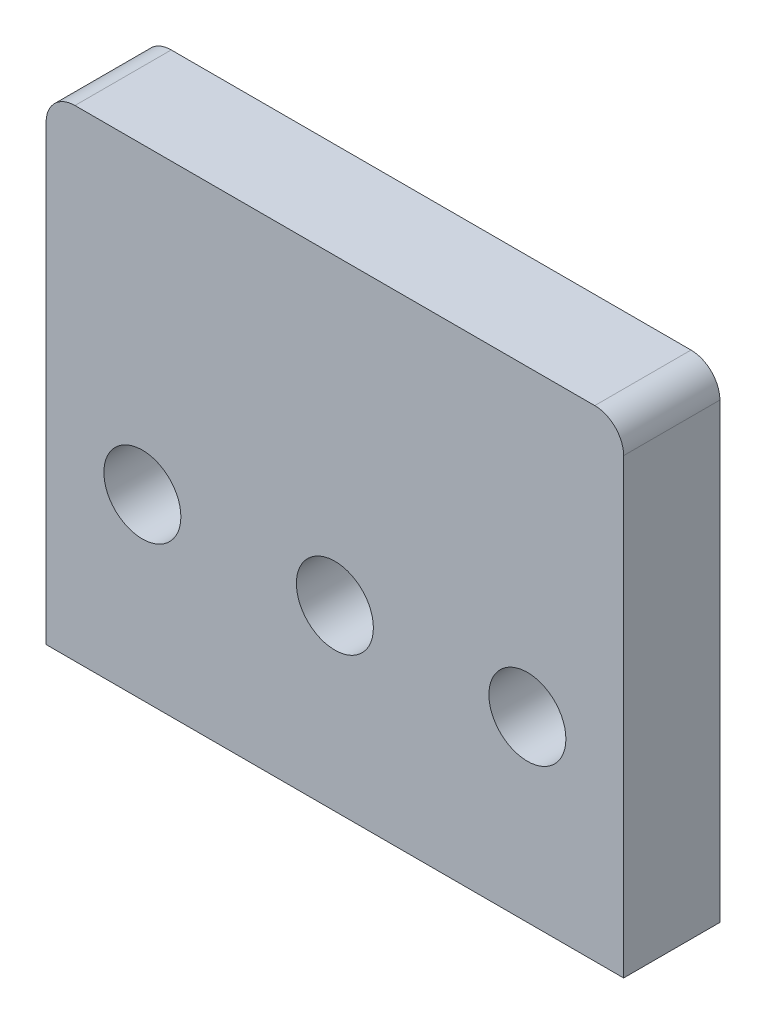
SolidWorks part; units mm, degrees
ref_plane "Plan1" through (0, 0, 0) normal (0, 0, 1) x (1, 0, 0)
ref_plane "Plan2" through (0, 0, 0) normal (0, 1, 0) x (1, 0, 0)
ref_plane "Plan3" through (0, 0, 0) normal (1, 0, 0) x (0, 0, -1)
sketch "Esquisse1" plane through (0, 0, 0) normal (0, 0, 1) x (1, 0, 0)
  line L0 (-30, -18.5) -> (30, -18.5)
  line L1 (-30, -18.5) -> (-30, 31.5)
  line L2 (30, 31.5) -> (-30, 31.5)
  line L3 (30, 31.5) -> (30, -18.5)
extrude "Base-Extrusion" add sketch "Esquisse1" along normal blind 10
fillet "Congé1" radius 3
sketch "Esquisse2" plane through (0, 0, 10) normal (0, 0, 1) x (1, 0, 0)
  circle A0 centre (-20, 0) radius 4
  circle A1 centre (0, 0) radius 4
  circle A2 centre (20, 0) radius 4
  dimension "D1" = 8
  dimension "D2" = 8
  dimension "D3" = 8
extrude "Enlèv. mat.-Extru.1" cut sketch "Esquisse2" against normal blind 10
sketch "Esquisse3" plane through (0, 0, 10) normal (0, 0, 1) x (1, 0, 0)
  line L0 (20, 22) -> (20, -14) construction
ref_plane "Plan5" [suppressed] through (0.4943, 0, 10.8857) normal (0.0454, 0, 0.999) x (0.999, 0, -0.0454)
sketch "Esquisse5" plane through (0, 0, 10) normal (0, 0, 1) x (1, 0, 0)
  line L0 (-24, 33) -> (-24, 5) construction
sketch "Esquisse6" [suppressed] plane through (0.4943, 0, 10.8857) normal (0.0454, 0, 0.999) x (0.999, 0, -0.0454)
  line L0 (-33, 26.1607) -> (36, 26.1607) construction
  line L3 (-24.4289, 33) -> (-24.4289, 5) construction
  line L4 (-24.4289, 29.3357) -> (19.3871, 29.3357)
  line L5 (22.5621, 26.1607) -> (-27.6039, 26.1607)
  arc A0 (19.3871, 29.3357) -> (22.5621, 26.1607) centre (19.3871, 26.1607) cw
  arc A1 (-24.4289, 29.3357) -> (-27.6039, 26.1607) centre (-24.4289, 26.1607) ccw
  dimension "D1" = 3.175
revolve "Enlever de la matière-Révolution1" [suppressed] cut sketch "Esquisse6" angle 360 about L0
sketch "Esquisse7" [suppressed] plane through (0.4943, 0, 10.8857) normal (0.0454, 0, 0.999) x (0.999, 0, -0.0454)
  line L0 (-34, 15.5) -> (32, 15.5) construction
  line L1 (26.5186, 31.5) -> (-27.4258, 31.5) construction
  line L2 (-24.4289, 12.32) -> (19.5258, 12.32)
  line L5 (-24.4289, 33) -> (-24.4289, 5) construction
  line L6 (19.5258, 22) -> (19.5258, -14) construction
  line L7 (22.7058, 15.5) -> (-27.6089, 15.5)
  arc A0 (19.5258, 12.32) -> (22.7058, 15.5) centre (19.5258, 15.5) ccw
  arc A1 (-24.4289, 12.32) -> (-27.6089, 15.5) centre (-24.4289, 15.5) cw
  dimension "D1" = 16
revolve "Enlever de la matière-Révolution2" [suppressed] cut sketch "Esquisse7" angle 360 about L0
